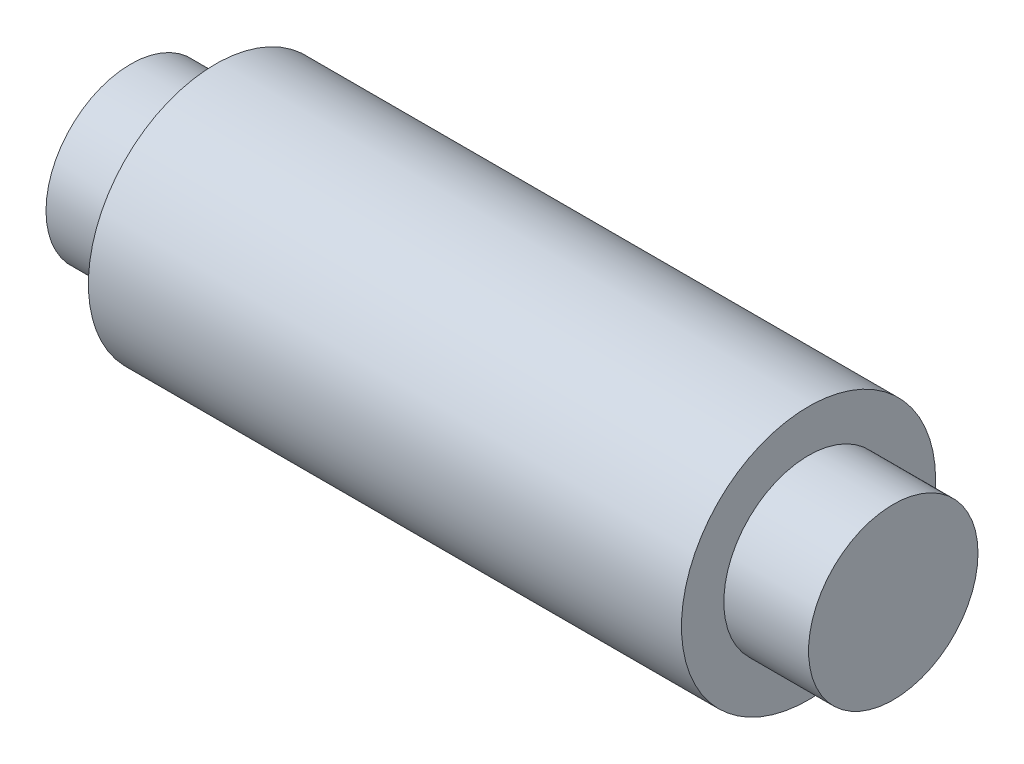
SolidWorks part; units mm, degrees
ref_plane "Front Plane" through (0, 0, 0) normal (0, 0, 1) x (1, 0, 0)
ref_plane "Top Plane" through (0, 0, 0) normal (0, 1, 0) x (1, 0, 0)
ref_plane "Right Plane" through (0, 0, 0) normal (1, 0, 0) x (0, 0, -1)
sketch "Sketch_Rolling Wheel" plane through (0, 0, 0) normal (1, 0, 0) x (0, 0, -1)
  circle A0 centre (0, 0) radius 15
  dimension "D1" = 30
extrude "Rolling Wheel" add sketch "Sketch_Rolling Wheel" along normal mid plane 70
sketch "Sketch_Wheel Shaft_ Right" plane through (35, 0, 0) normal (1, 0, 0) x (0, 0, -1)
  circle A0 centre (0, 0) radius 10
  dimension "D1" = 20
extrude "Wheel Shaft_ Right" add sketch "Sketch_Wheel Shaft_ Right" along normal blind 10
sketch "Sketch_Wheel Shaft_ Left" plane through (-35, 0, 0) normal (-1, 0, 0) x (0, 0, 1)
  circle A1 centre (0, 0) radius 10
  circle A2 centre (0, 0) radius 10
  dimension "D1" = 0
extrude "Wheel Shaft_ Left" add sketch "Sketch_Wheel Shaft_ Left" along normal blind 10
